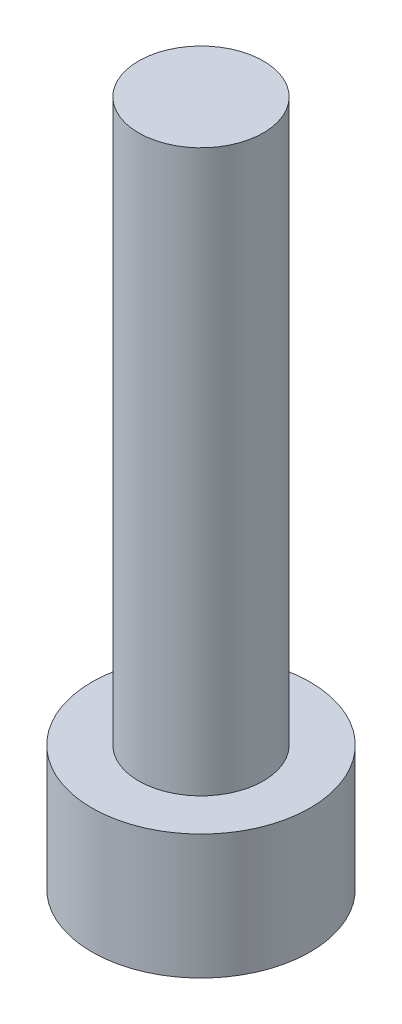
SolidWorks part; units mm, degrees
ref_plane "前视基准面" through (0, 0, 0) normal (0, 0, 1) x (1, 0, 0)
ref_plane "上视基准面" through (0, 0, 0) normal (0, 1, 0) x (1, 0, 0)
ref_plane "右视基准面" through (0, 0, 0) normal (1, 0, 0) x (0, 0, -1)
other "Configuration Table"
sketch "草图1" plane through (0, 0, 0) normal (0, 1, 0) x (1, 0, 0)
  circle A0 centre (0, 0) radius 3.5
  dimension "D1" = 7
extrude "凸台-拉伸1" add sketch "草图1" along normal blind 4
sketch "草图2" plane through (0, 4, 0) normal (0, 1, 0) x (1, 0, 0)
  circle A0 centre (0, 0) radius 2
  dimension "D1" = 4
extrude "凸台-拉伸2" add sketch "草图2" along normal blind 18
sketch "草图3" plane through (0, 0, 0) normal (0, -1, 0) x (1, 0, 0)
  line L1 (1.2713, -1.1763) -> (1.6544, 0.5128)
  line L2 (1.6544, 0.5128) -> (0.3831, 1.6892)
  line L3 (0.3831, 1.6892) -> (-1.2713, 1.1763)
  line L4 (-1.2713, 1.1763) -> (-1.6544, -0.5128)
  line L5 (-1.6544, -0.5128) -> (-0.3831, -1.6892)
  line L6 (-0.3831, -1.6892) -> (1.2713, -1.1763)
  circle A0 centre (0, 0) radius 1.5 construction
  dimension "D1" = 3
extrude "切除-拉伸1" cut sketch "草图3" against normal blind 1.5
